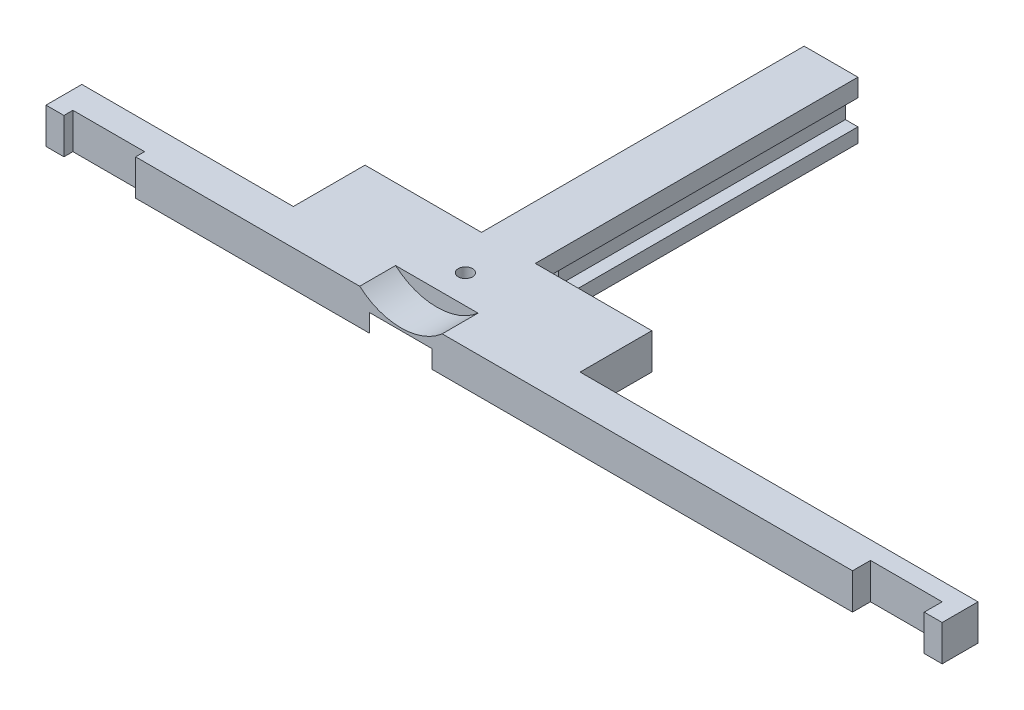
SolidWorks part; units mm, degrees
ref_plane "前视基准面" through (0, 0, 0) normal (0, 0, 1) x (1, 0, 0)
ref_plane "上视基准面" through (0, 0, 0) normal (0, 1, 0) x (1, 0, 0)
ref_plane "右视基准面" through (0, 0, 0) normal (1, 0, 0) x (0, 0, -1)
other "Configuration Table"
sketch "草图2" plane through (0, 0, 0) normal (0, 1, 0) x (1, 0, 0)
  line L0 (-74, 33.377) -> (-74, -48.7019) construction
  line L1 (-99, 30) -> (151, 30)
  line L2 (-99, 30) -> (-99, 0)
  line L5 (151, 30) -> (151, 0)
  line L6 (146, 0) -> (146, 5)
  line L7 (-74, 2.5) -> (-94, 2.5)
  line L8 (-94, 2.5) -> (-94, 0)
  line L10 (0, 0) -> (-148.1012, 0) construction
  line L11 (-74, 2.5) -> (-74, 0)
  line L12 (0, 0) -> (0, -39.3988) construction
  line L17 (0, 0) -> (155.0364, 0) construction
  line L18 (-99, 0) -> (-94, 0)
  line L19 (-74, 0) -> (126, 0)
  line L21 (146, 5) -> (126, 5)
  line L22 (126, 5) -> (126, 0)
  line L23 (146, 0) -> (151, 0)
  dimension "D1" = 2.5
  dimension "D6" = 225
  dimension "D2" = 5
  dimension "D3" = 74
  dimension "D4" = 20
  dimension "D5" = 30
  dimension "D7" = 20
  dimension "D8" = 5
  dimension "D9" = 5
extrude "凸台-拉伸1" add sketch "草图2" along normal blind 10
sketch "草图3" plane through (0, 10, 0) normal (0, 1, 0) x (1, 0, 0)
  line L0 (-74, 0) -> (126, 0) construction
  line L1 (0, 18) -> (0, 0) construction
  circle A0 centre (0, 18) radius 20
  dimension "D2" = 40
  dimension "D1" = 18
extrude "切除-拉伸1" cut sketch "草图3" along normal blind 5 from offset 10
sketch "草图4" plane through (0, 10, 0) normal (0, 1, 0) x (1, 0, 0)
  line L0 (-99, 10) -> (-40, 10)
  line L1 (-99, 30) -> (-99, 0) construction
  line L2 (151, 10) -> (40, 10)
  line L3 (151, 0) -> (151, 30) construction
  line L4 (-74, 0) -> (126, 0) construction
  line L5 (151, 10) -> (151, 30)
  line L6 (151, 30) -> (40, 30)
  line L7 (-99, 30) -> (-99, 10)
  line L8 (151, 30) -> (-99, 30) construction
  line L9 (-40, 10) -> (-40, 30)
  line L10 (40, 10) -> (40, 30)
  line L11 (-40, 30) -> (-99, 30)
  dimension "D1" = 80
  dimension "D2" = 10
  dimension "D3" = 111
  dimension "D4" = 20
extrude "切除-拉伸2" cut sketch "草图4" against normal blind 10
sketch "草图5" plane through (0, 0, 0) normal (0, -1, 0) x (1, 0, 0)
  line L0 (0, -18) -> (-42.0168, -18) construction
  line L1 (0, -18) -> (0, -37.4381) construction
  circle A0 centre (-30, -18) radius 2
  circle A1 centre (30, -18) radius 2
  dimension "D1" = 4
  dimension "D2" = 30
extrude "凸台-拉伸2" add sketch "草图5" along normal blind 10
sketch "草图6" plane through (0, 0, -30) normal (0, 0, -1) x (-1, 0, 0)
  line L0 (-7.5, 10) -> (-7.5, 5)
  line L1 (0, 10) -> (0, 2.7319) construction
  line L2 (-40, 10) -> (40, 10) construction
  line L3 (7.5, 10) -> (-7.5, 10)
  line L4 (-16, 5) -> (16, 5) construction
  line L5 (-7.5, 5) -> (7.5, 5)
  line L6 (7.5, 10) -> (7.5, 5)
  point P12 (0, 5)
  dimension "D1" = 7.5
extrude "凸台-拉伸3" add sketch "草图6" along normal blind 10
sketch "草图8" plane through (0, 0, -40) normal (0, 0, -1) x (-1, 0, 0)
  line L0 (-7.5, 10) -> (7.5, 10)
  line L1 (-7.5, 10) -> (-7.5, 5)
  line L2 (-7.5, 10) -> (-7.5, 5) construction
  line L3 (-7.5, 5) -> (-4, 5)
  line L4 (-4, 5) -> (-4, -2)
  line L5 (-4, -2) -> (-7.5, -2)
  line L6 (-7.5, -2) -> (-7.5, -6)
  line L7 (-7.5, -6) -> (7.5, -6)
  line L8 (0, 10) -> (0, -6) construction
  line L10 (7.5, 5) -> (4, 5)
  line L11 (7.5, 10) -> (7.5, 5)
  line L12 (4, 5) -> (4, -2)
  line L13 (4, -2) -> (7.5, -2)
  line L14 (7.5, -2) -> (7.5, -6)
  dimension "D1" = 16
  dimension "D2" = 5
  dimension "D3" = 7
  dimension "D4" = 3.5
extrude "凸台-拉伸4" add sketch "草图8" along normal blind 80
sketch "草图9" plane through (0, 0, 0) normal (0, 0, 1) x (1, 0, 0)
  circle A0 centre (0.0192, 23.1878) radius 17.5
  dimension "D1" = 35
extrude "切除-拉伸3" cut sketch "草图9" against normal blind 10
sketch "草图10" plane through (0, 5, 0) normal (0, -1, 0) x (1, 0, 0)
  circle A0 centre (0, -18) radius 2
  dimension "D1" = 4
extrude "切除-拉伸4" cut sketch "草图10" against normal blind 10
